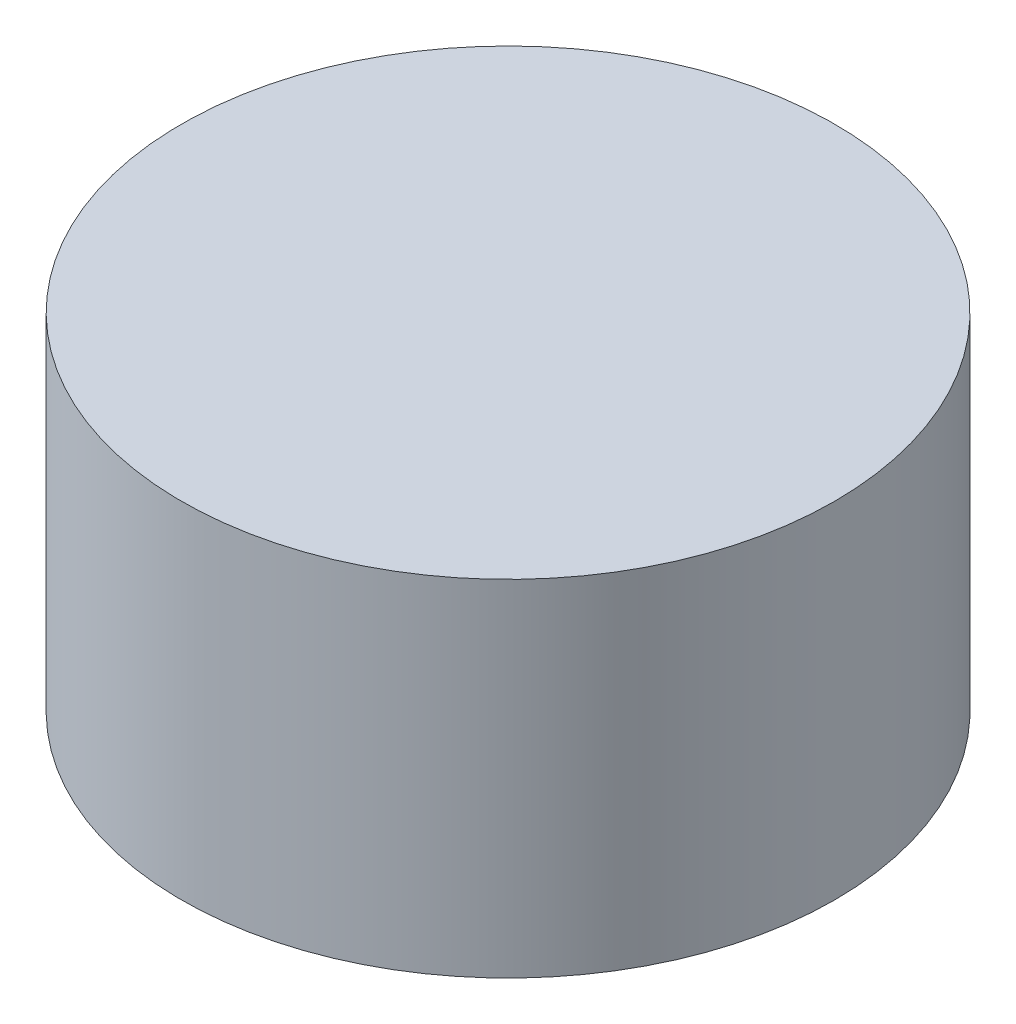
SolidWorks part; units mm, degrees
ref_plane "Plan de face" through (0, 0, 0) normal (0, 0, 1) x (1, 0, 0)
ref_plane "Plan de dessus" through (0, 0, 0) normal (0, 1, 0) x (1, 0, 0)
ref_plane "Plan de droite" through (0, 0, 0) normal (1, 0, 0) x (0, 0, -1)
sketch "Esquisse1" plane through (0, 0, 0) normal (0, 0, 1) x (1, 0, 0)
  line L0 (0, 0) -> (0, 1.85) construction
  line L1 (-1.5, 0) -> (-1.75, 0)
  line L2 (-1.75, 0) -> (-1.75, 1.85)
  line L3 (-1.75, 1.85) -> (0, 1.85)
  line L4 (-1.5, 0) -> (-1.5, 0.75)
  line L6 (0, 1.85) -> (0, 1.3274)
  line L7 (-1.5, 0.75) -> (-1, 0.75)
  line L8 (-1, 0.75) -> (0, 1.3274)
  dimension "D1" = 3
  dimension "D3" = 1.85
  dimension "D4" = 0.75
  dimension "D5" = 3.5
  dimension "D6" = 2
  dimension "D7" = 60
revolve "Révolution1" add sketch "Esquisse1" angle 360 about L0
